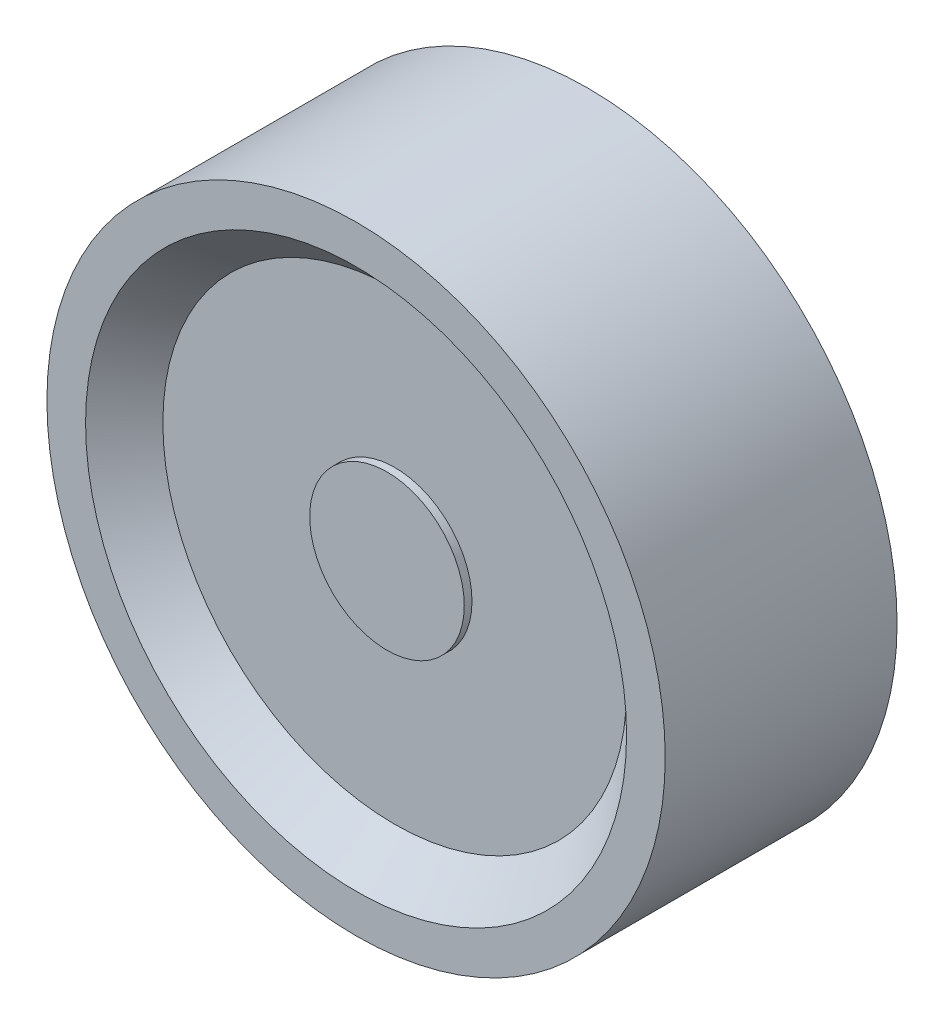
SolidWorks part; units mm, degrees
ref_plane "Front Plane" through (0, 0, 0) normal (0, 0, 1) x (1, 0, 0)
ref_plane "Top Plane" through (0, 0, 0) normal (0, 1, 0) x (1, 0, 0)
ref_plane "Right Plane" through (0, 0, 0) normal (1, 0, 0) x (0, 0, -1)
imported_body "Wheel.step<1>"
sketch "Sketch1" plane through (0, 0, 0) normal (0, 0, -1) x (-1, 0, 0)
  line L0 (0, 101.6) -> (0, -101.6) construction
  line L1 (-101.6, 0) -> (101.6, 0) construction
  circle A0 centre (0, 0) radius 101.6 construction
  circle A1 centre (0, 0) radius 2.54
  dimension "D1" = 5.08
extrude "Cut-Extrude1" cut sketch "Sketch1" against normal blind 5.08
